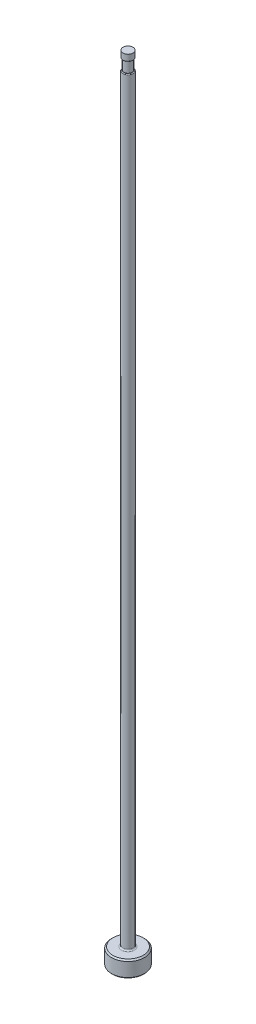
SolidWorks part; units mm, degrees
ref_plane "Front Plane" through (0, 0, 0) normal (0, 0, 1) x (1, 0, 0)
ref_plane "Top Plane" through (0, 0, 0) normal (0, 1, 0) x (1, 0, 0)
ref_plane "Right Plane" through (0, 0, 0) normal (1, 0, 0) x (0, 0, -1)
other "Configuration Table"
sketch "Sketch1" plane through (0, 0, 0) normal (0, 0, 1) x (1, 0, 0)
  line L0 (0, 259.9588) -> (0, -15.1925) construction
  line L1 (0, 0) -> (-3.175, 0)
  line L2 (-3.175, 0) -> (-3.175, 3.175)
  line L3 (-3.175, 3.175) -> (-0.9919, 3.175)
  line L4 (-0.9919, 3.175) -> (-0.9919, 152.4)
  line L5 (-0.9919, 152.4) -> (0, 152.4)
  line L6 (0, 152.4) -> (0, 0)
  dimension "L" = 152.4
  dimension "H" = 6.35
  dimension "T" = 3.175
  dimension "D" = 1.9837
revolve "Revolve1" add sketch "Sketch1" angle 360 about L0
chamfer "Chamfer1" distance 0.254 angle 45 2 edges at (0, 3.175, 3.175) (0, 0, 3.175)
fillet "Fillet1" radius 0.254 1 edges at (0, 3.175, 0.9919)
sketch "Sketch2" plane through (0, 0, 0) normal (0, 0, 1) x (1, 0, 0)
  line L0 (-0.9919, 152.4) -> (-0.9919, 3.429) construction
  line L1 (-0.9919, 151.13) -> (-0.7887, 151.13)
  line L2 (-0.9919, 151.13) -> (-0.9919, 149.098)
  line L3 (-0.9919, 149.098) -> (-0.7887, 149.098)
  line L4 (-0.7887, 151.13) -> (-0.7887, 149.098)
  line L5 (0.9919, 152.4) -> (-0.9919, 152.4) construction
  line L6 (0, 153.4483) -> (0, 147.3282) construction
  dimension "D1" = 2.032
  dimension "N" = 1.27
  dimension "FD" = 0.2032
  dimension "D3" = 1.5773
revolve "Vent Relief" cut sketch "Sketch2" angle 360 about L6
sketch "Sketch3" plane through (0, 0, 0) normal (0, 0, 1) x (1, 0, 0)
  line L0 (-0.7887, 150.114) -> (-0.7887, 86.614)
  line L1 (-0.7887, 151.13) -> (-0.7887, 149.098) construction
  line L2 (-0.9919, 149.098) -> (-0.9919, 3.429) construction
  line L3 (-0.9919, 85.4964) -> (-0.9919, 150.114)
  line L4 (-0.9919, 150.114) -> (-0.7887, 150.114)
  arc A0 (-0.7887, 86.614) -> (-0.9919, 85.4964) centre (-3.9637, 86.614) cw
  dimension "D1" = 3.175
  dimension "D2" = 63.5
extrude "D-Slot" cut sketch "Sketch3" against normal through all both and the other way through all
sketch "Sketch5" plane through (0, 0, 0) normal (0, 0, 1) x (1, 0, 0)
  line L0 (-0.9919, 151.13) -> (0.9919, 151.13) construction
  line L1 (-0.9919, 152.4) -> (-0.9728, 152.4)
  line L2 (-0.9919, 152.4) -> (-0.9919, 151.13)
  line L3 (-0.9919, 151.13) -> (-0.9728, 151.13)
  line L4 (-0.9728, 152.4) -> (-0.9728, 151.13)
  line L5 (0, 152.6877) -> (0, 150.5771) construction
  dimension "VP" = 0.019
revolve "Vent Diameter" cut sketch "Sketch5" angle 360 about L5
fillet "Fillet2" radius 0.127 2 edges at (0.9919, 149.098, 0) (0, 151.13, 0.9728)
sketch "Pocket Sketch" plane through (0, 0, 0) normal (0, 0, 1) x (1, 0, 0)
  line L0 (-3.5719, 0) -> (-3.5719, 3.2004)
  line L1 (-3.5719, 3.2004) -> (-1.9523, 3.2004)
  line L2 (-1.1903, 3.9624) -> (-1.1903, 22.225)
  line L3 (-1.1903, 22.225) -> (0, 22.225)
  line L4 (0, 22.225) -> (0, 0)
  line L5 (0, 0) -> (-3.5719, 0)
  line L6 (0, 12.6104) -> (0, -2.4989) construction
  line L7 (-3.175, 2.921) -> (-3.175, 0.254) construction
  line L8 (2.921, 3.175) -> (-2.921, 3.175) construction
  line L9 (-0.9919, 85.4964) -> (-0.9919, 3.429) construction
  line L10 (-1.9523, 3.2004) -> (-1.1903, 3.9624)
  point P3 (-1.1903, 3.2004)
  dimension "D1" = 7.1437
  dimension "D2" = 0.3969
  dimension "D3" = 0.0254
  dimension "D4" = 0.1984
  dimension "D5" = 2.3806
  dimension "D6" = 22.225
